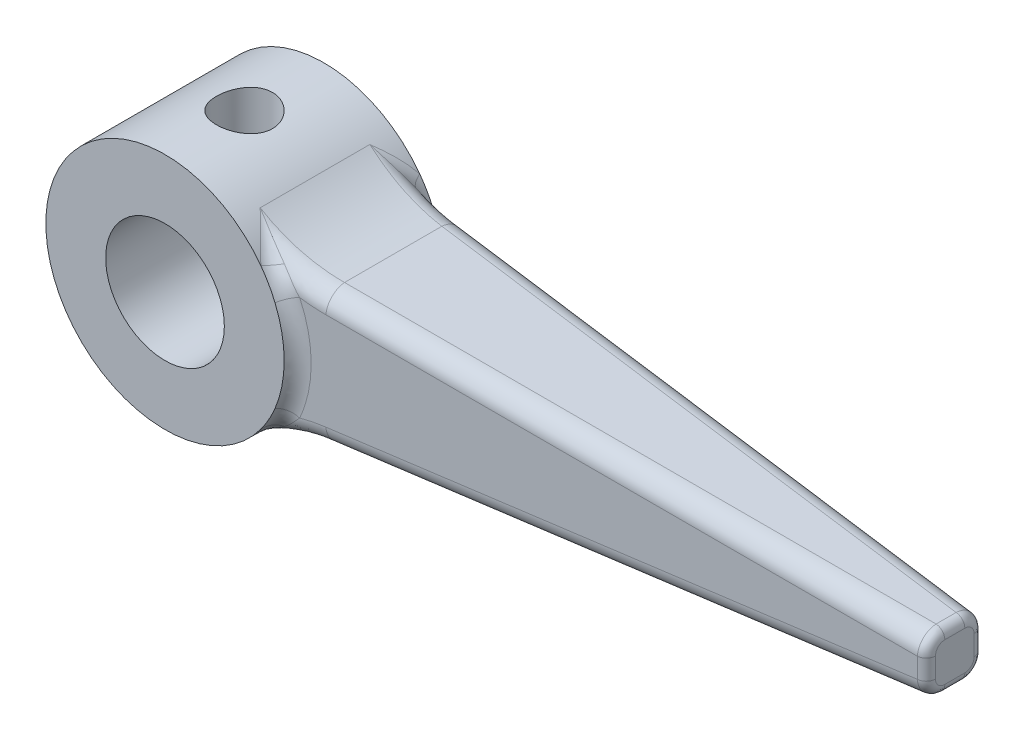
SolidWorks part; units mm, degrees
ref_plane "Front Plane" through (0, 0, 0) normal (0, 0, 1) x (1, 0, 0)
ref_plane "Top Plane" through (0, 0, 0) normal (0, 1, 0) x (1, 0, 0)
ref_plane "Right Plane" through (0, 0, 0) normal (1, 0, 0) x (0, 0, -1)
sketch "Sketch1" plane through (0, 0, 0) normal (0, 0, 1) x (1, 0, 0)
  circle A0 centre (0, 0) radius 3.175
  circle A1 centre (0, 0) radius 6.375
  dimension "D1" = 6.35
  dimension "D2" = 12.75
extrude "Boss-Extrude1" add sketch "Sketch1" along normal mid plane 8.5
ref_plane "Plane1" through (38, 0, 0) normal (1, 0, 0) x (0, 0, -1)
sketch "Sketch2" plane through (38, 0, 0) normal (1, 0, 0) x (0, 0, -1)
  line L0 (0, 0) -> (0, 5.643) construction
  line L1 (-1.5, 1.5) -> (1.5, 1.5)
  line L2 (-1.5, 1.5) -> (-1.5, -1.5)
  line L3 (-1.5, -1.5) -> (1.5, -1.5)
  line L4 (1.5, 1.5) -> (1.5, -1.5)
  line L5 (0, 0) -> (6.1115, 0) construction
  dimension "D1" = 3
  dimension "D2" = 3
extrude "Boss-Extrude2" add sketch "Sketch2" against normal up to next draft 4
fillet "Fillet1" radius 8 2 edges at (5.1192, -3.7992, 0) (5.1192, 3.7992, 0)
fillet "Fillet4" radius 1 8 edges at (5.758, -4.0716, -3.7546) (5.758, 4.0716, -3.7546) (22.9787, -2.5504, 2.5504) (5.758, 4.0716, 3.7546) (22.9787, -2.5504, -2.5504) (22.9787, 2.5504, -2.5504) (5.758, -4.0716, 3.7546) (22.9787, 2.5504, 2.5504)
fillet "Fillet5" radius 1 4 edges at (5.103, -3.821, -3.6671) (5.103, 3.821, -3.6671) (5.103, -3.821, 3.6671) (5.103, 3.821, 3.6671)
fillet "Fillet6" radius 0.5 8 edges at (38, 1.2081, 1.2081) (38, 1.5, 0) (38, 1.2081, -1.2081) (38, 0, -1.5) (38, -1.2081, -1.2081) (38, -1.5, 0) (38, -1.2081, 1.2081) (38, 0, 1.5)
sketch "Sketch3" plane through (0, 0, 0) normal (0, 1, 0) x (1, 0, 0)
  circle A0 centre (0, 0) radius 1.5
  dimension "D1" = 3
extrude "Cut-Extrude1" cut sketch "Sketch3" along normal blind 10
